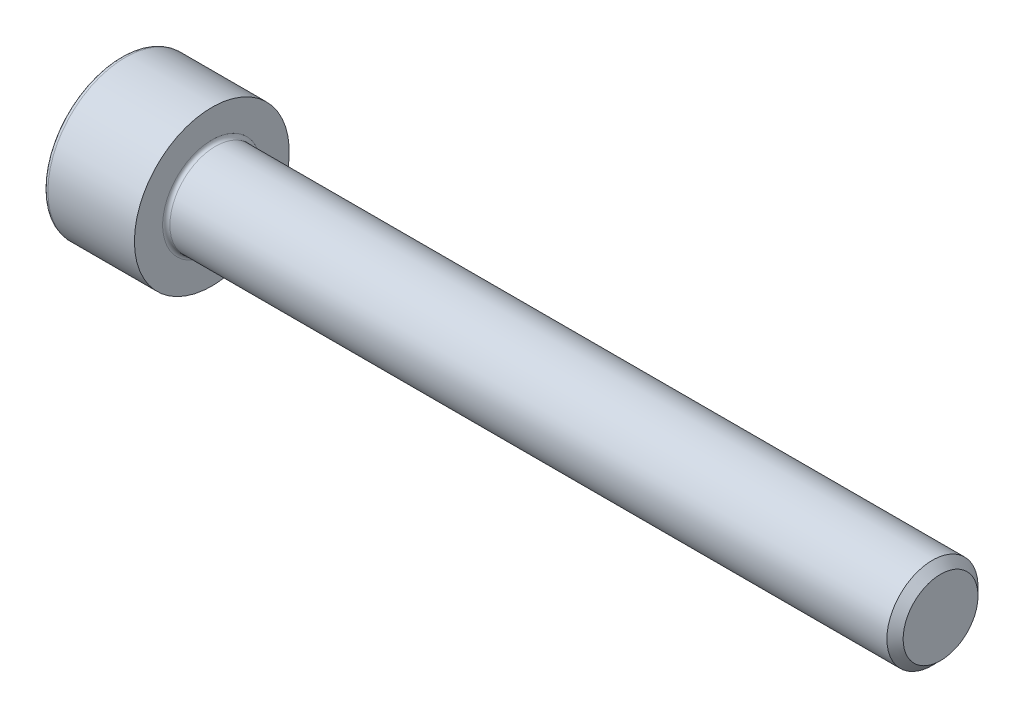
SolidWorks part; units mm, degrees
ref_plane "Plane1" through (0, 0, 0) normal (0, 0, 1) x (1, 0, 0)
ref_plane "Plane2" through (0, 0, 0) normal (0, 1, 0) x (1, 0, 0)
ref_plane "Plane3" through (0, 0, 0) normal (1, 0, 0) x (0, 0, -1)
sketch "BodySke" plane through (0, 0, 0) normal (0, 0, 1) x (1, 0, 0)
  line L0 (0, 0) -> (0, 4.25)
  line L1 (0, 4.25) -> (5, 4.25)
  line L2 (5, 4.25) -> (5, 2.5)
  line L3 (5, 2.5) -> (44.555, 2.5)
  line L4 (45, 2.055) -> (45, 0)
  line L5 (45, 0) -> (0, 0)
  line L6 (-31.75, 0) -> (127, 0) construction
  line L8 (45, 2.055) -> (44.555, 2.5)
  line L10 (45, -2.055) -> (44.555, -2.5) construction
  line L11 (5.8, 9.525) -> (5.8, 3.175) construction
  line L12 (5, 9.525) -> (5, 3.175) construction
  line L13 (-15, 9.525) -> (-15, 3.175) construction
  dimension "Diameter" = 5
  dimension "Head_ht" = 5
  dimension "Length" = 40
  dimension "Body_ch_ang" = 45
  dimension "Head_dia" = 8.5
  dimension "Minor_dia" = 4.11
  dimension "Advance" = 0.8
  dimension "Thread_nom" = 40
  dimension "Thread_length" = 60
revolve "Base-Revolve" add sketch "BodySke"
fillet "Fillet1" radius 0.2 1 edges at (5, 0, 2.5)
fillet "Fillet2" radius 0.25 1 edges at (0, 0, 4.25)
sketch "Sketch2" plane through (0, 0, 0) normal (0, 0, 1) x (1, 0, 0)
  line L0 (0, 2.042) -> (2.5, 2.042)
  line L1 (2.5, 2.042) -> (3.6789, 0)
  line L2 (-31.75, 0) -> (127, 0) construction
  line L3 (3.6789, 0) -> (0, 0)
  line L4 (0, 0) -> (0, 2.042)
  line L6 (0, 0) -> (47.625, 0) construction
  dimension "D1" = 2.042
  dimension "D2" = 60
  dimension "Depth" = 2.5
revolve "Hex-PreBroach" cut sketch "Sketch2" angle 360 about L6
sketch "Sketch3" plane through (0, 0, 0) normal (-1, 0, 0) x (0, 0.5, 0.866)
  line L0 (1.1789, 2.042) -> (-1.1789, 2.042)
  line L1 (-1.1789, 2.042) -> (-2.3579, 0)
  line L2 (1.1789, 2.042) -> (2.3579, 0)
  line L3 (1.1789, -2.042) -> (2.3579, 0)
  line L4 (1.1789, -2.042) -> (-1.1789, -2.042)
  line L5 (-1.1789, -2.042) -> (-2.3579, 0)
  dimension "D1" = 2.042
  dimension "D2" = 2.042
  dimension "Hex_size" = 4.084
extrude "Hex" cut sketch "Sketch3" against normal blind 2.5
sketch "ThdSchSke" plane through (0, 0, 0) normal (0, 0, 1) x (1, 0, 0)
  line L0 (7.4, -2.055) -> (7.0884, -2.5)
  line L1 (7.4, -2.055) -> (7.7116, -2.5)
  line L2 (7.7116, -2.5) -> (7.7116, -3.125)
  line L3 (-3.175, 0) -> (5.1513, 0) construction
  line L4 (0, 4) -> (0, -4) construction
  line L5 (7.7116, -3.125) -> (7.0884, -3.125)
  line L6 (7.0884, -3.125) -> (7.0884, -2.5)
  dimension "Thread_minor" = 4.11
  dimension "Diameter" = 5
  dimension "Start" = 7.4
  dimension "SideAngle" = 55
  dimension "VeeAngle" = 70
  dimension "Overcut" = 6.25
revolve "ThreadSchematic" [suppressed] cut sketch "ThdSchSke" angle 360 about L3
pattern_linear "ThdSchPat" [suppressed]
equation "\"D2@Sketch3\" = \"Hex_size@Sketch3\" / 2"
equation "\"D1@Sketch3\" = \"Hex_size@Sketch3\" / 2"
equation "\"D1@Sketch2\" = \"Hex_size@Sketch3\" / 2"
equation "\"Thread_minor@ThreadCosmetic\"  =  \"Minor_dia@BodySke\""
equation "\"Depth@Sketch2\" =  \"Key_eng@Hex\""
equation "\"Thread_length@ThreadCosmetic\" = ((sgn( (\"Length@BodySke\" - \"Advance@BodySke\" * 3.0) - \"Thread_nom@BodySke\" )-1)*( (\"Length@BodySke\" - \"Advance@BodySke\" * 3.0) - \"Thread_nom@BodySke\" ))/-2+ \"Thread_no"
equation "\"Thread_minor@ThdSchSke\" = \"Minor_dia@BodySke\""
equation "\"Diameter@ThdSchSke\" = \"Diameter@BodySke\""
equation "\"Overcut@ThdSchSke\" = \"Diameter@BodySke\" * 1.25"
equation "\"Start@ThdSchSke\" = \"Head_ht@BodySke\" + \"Length@BodySke\" - \"Thread_length@ThreadCosmetic\"  '---Non-countersunk---"
equation "\"Num_threads@ThdSchPat\" = int( \"Thread_length@ThreadCosmetic\" / \"Advance@BodySke\" + 0.999 )  + 1"
equation "\"Advance@ThdSchPat\" = \"Thread_length@ThreadCosmetic\" /  (\"Num_threads@ThdSchPat\" - 1) 'relax it"
equation "\"Num_threads@ThdSchPat\" = \"Num_threads@ThdSchPat\" - sgn( \"Num_threads@ThdSchPat\" - 1) '---chamfered tips only---"
